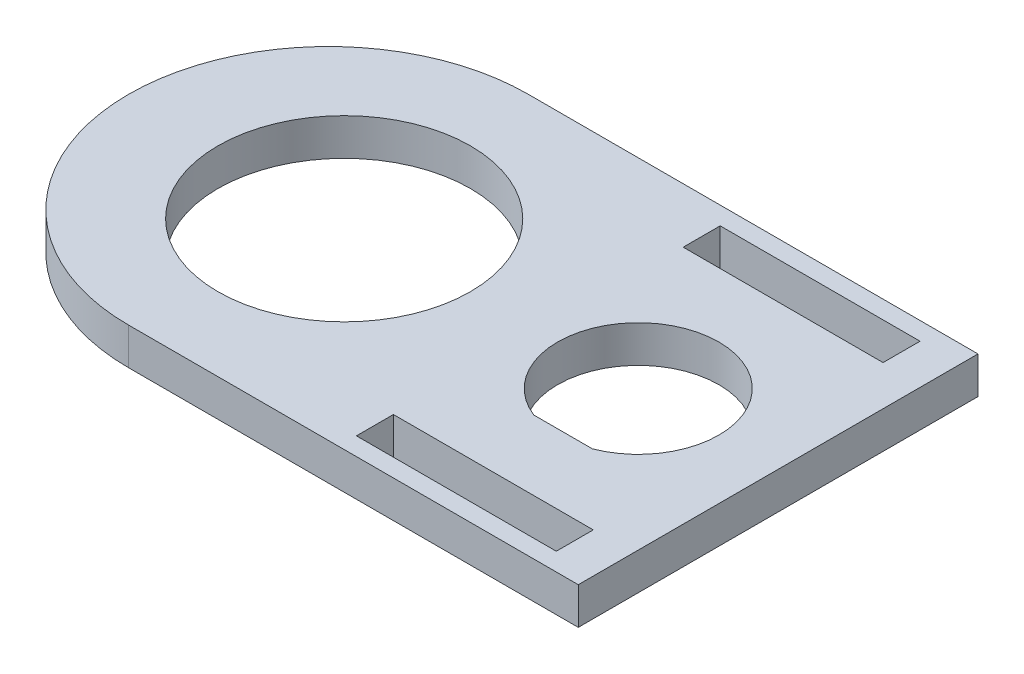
SolidWorks part; units mm, degrees
ref_plane "Front Plane" through (0, 0, 0) normal (0, 0, 1) x (1, 0, 0)
ref_plane "Top Plane" through (0, 0, 0) normal (0, 1, 0) x (1, 0, 0)
ref_plane "Right Plane" through (0, 0, 0) normal (1, 0, 0) x (0, 0, -1)
sketch "Sketch1" plane through (0, 0, 0) normal (0, 1, 0) x (1, 0, 0)
  line L1 (-41.275, 25.4) -> (41.275, 25.4)
  line L2 (-41.275, 25.4) -> (-41.275, -25.4)
  line L3 (-41.275, -25.4) -> (41.275, -25.4)
  line L4 (41.275, 25.4) -> (41.275, -25.4)
  line L5 (-41.275, 25.4) -> (41.275, -25.4) construction
  line L6 (-41.275, -25.4) -> (41.275, 25.4) construction
  point P0 (0, 0)
  dimension "D1" = 82.55
  dimension "D2" = 50.8
extrude "Boss-Extrude1" add sketch "Sketch1" along normal mid plane 4.699
sketch "Sketch2" plane through (0, 2.3495, 0) normal (0, 1, 0) x (1, 0, 0)
  line L4 (36.195, -18.415) -> (10.795, -18.415)
  line L5 (36.195, -23.114) -> (36.195, -18.415)
  line L6 (10.795, -23.114) -> (36.195, -23.114)
  line L7 (36.195, -23.114) -> (36.195, -18.415)
  line L8 (36.195, -18.415) -> (10.795, -18.415)
  line L9 (10.795, -18.415) -> (10.795, -23.114)
  line L10 (10.795, -23.114) -> (36.195, -23.114)
  line L11 (10.795, -18.415) -> (10.795, -23.114)
  dimension "D1" = 0
extrude "Cut-Extrude1" cut sketch "Sketch2" against normal through all
mirror "Mirror1" about plane through (0, 0, 0) normal (0, 0, 1) of "Cut-Extrude1"
sketch "Sketch3" plane through (0, 2.3495, 0) normal (0, 1, 0) x (1, 0, 0)
  circle A1 centre (-13.8778, 0) radius 16.05
  circle A2 centre (-13.8778, 0) radius 16.05
  dimension "D1" = 0
extrude "Cut-Extrude2" cut sketch "Sketch3" against normal through all
sketch "Sketch4" plane through (0, 2.3495, 0) normal (0, 1, 0) x (1, 0, 0)
  line L1 (19.7721, -9.55) -> (27.2179, -9.55)
  line L2 (19.7721, -9.55) -> (27.2179, -9.55)
  arc A1 (27.2179, -9.55) -> (19.7721, -9.55) centre (23.495, 0) ccw
  arc A2 (27.2179, -9.55) -> (19.7721, -9.55) centre (23.495, 0) ccw
  dimension "D1" = 0
extrude "Cut-Extrude3" cut sketch "Sketch4" against normal through all
fillet "Fillet2" radius 25.4 2 edges at (-41.275, 0, -25.4) (-41.275, 0, 25.4)
